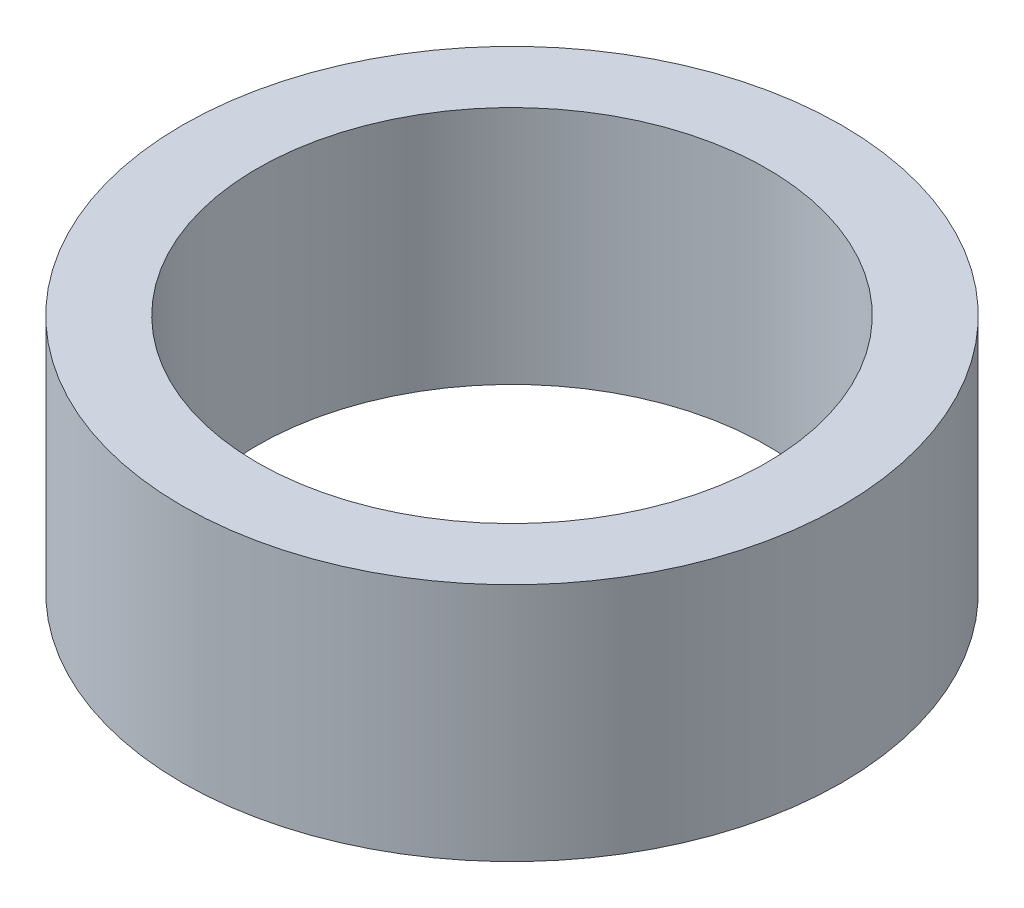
SolidWorks part; units mm, degrees
ref_plane "Plan1" through (0, 0, 0) normal (0, 0, 1) x (1, 0, 0)
ref_plane "Plan2" through (0, 0, 0) normal (0, 1, 0) x (1, 0, 0)
ref_plane "Plan3" through (0, 0, 0) normal (1, 0, 0) x (0, 0, -1)
sketch "Esquisse1" plane through (0, 0, 0) normal (0, 0, 1) x (1, 0, 0)
  line L0 (0, 90) -> (0, -90) construction
  line L2 (8.5, 50) -> (11, 50)
  line L3 (8.5, 50) -> (8.5, 42)
  line L4 (8.5, 42) -> (11, 42)
  line L5 (11, 50) -> (11, 42)
  dimension "D1" = 8.5
  dimension "D2" = 2.5
  dimension "D3" = 8
revolve "Base-Révolution" add sketch "Esquisse1" angle 360 about L0
